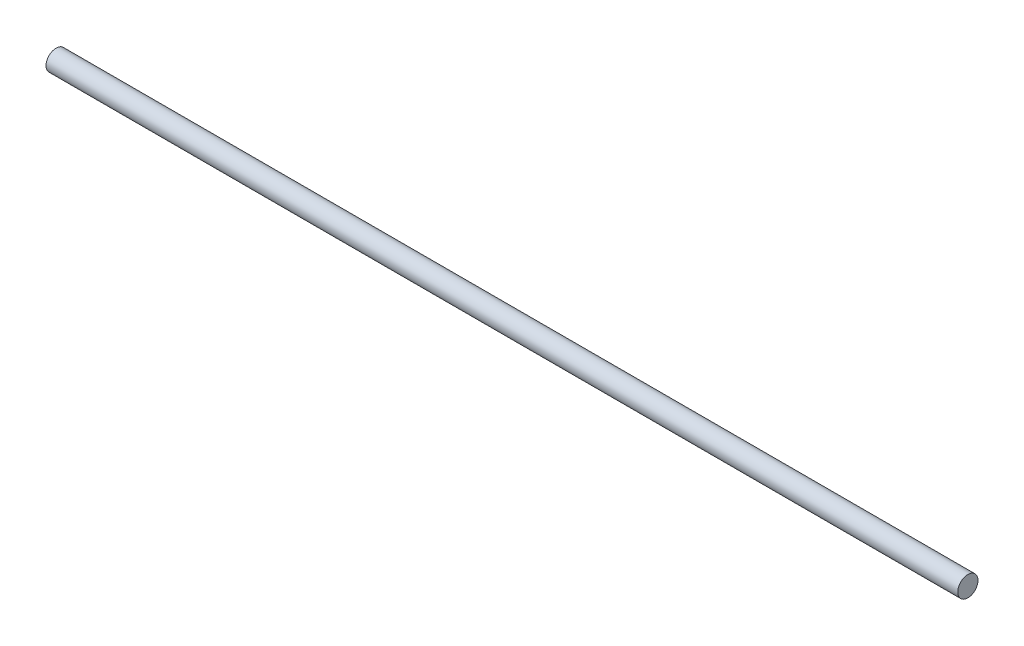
SolidWorks part; units mm, degrees
ref_plane "Plan de face" through (0, 0, 0) normal (0, 0, 1) x (1, 0, 0)
ref_plane "Plan de dessus" through (0, 0, 0) normal (0, 1, 0) x (1, 0, 0)
ref_plane "Plan de droite" through (0, 0, 0) normal (1, 0, 0) x (0, 0, -1)
sketch "Esquisse1" plane through (0, 0, 0) normal (1, 0, 0) x (0, 0, -1)
  circle A0 centre (0, 0) radius 1
extrude "Extrusion1" add sketch "Esquisse1" along normal blind 90
